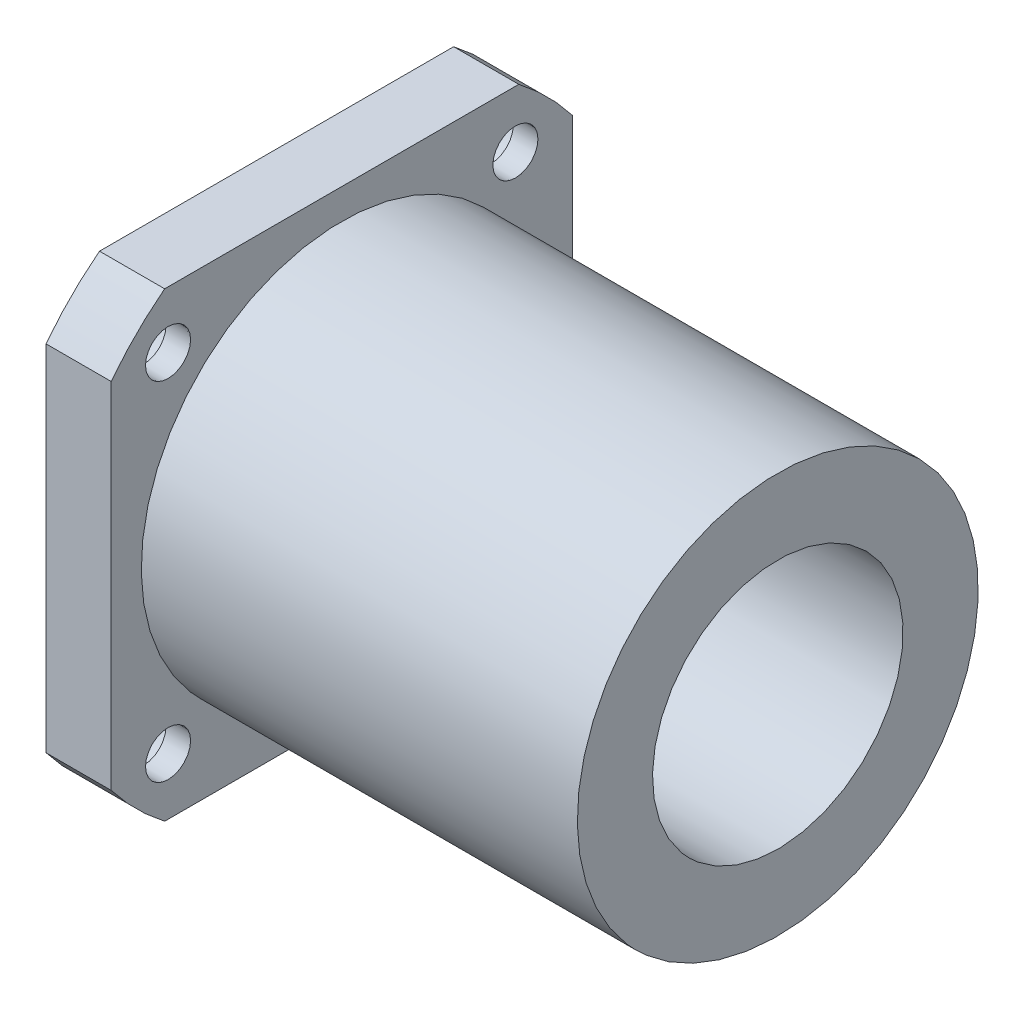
SolidWorks part; units mm, degrees
other "Solid1"
ref_plane "Front Plane" through (0, 0, 0) normal (0, 0, 1) x (1, 0, 0)
ref_plane "Top Plane" through (0, 0, 0) normal (0, 1, 0) x (1, 0, 0)
ref_plane "Right Plane" through (0, 0, 0) normal (1, 0, 0) x (0, 0, -1)
imported_body "2.7055 LMK50UU.stp<1>"
move or copy body "Body-Move/Copy1" bodies to move or copy 101 copy no rotation origin (0, 0, 0) rotation axis (1, 0, 0) rotation angle 45
